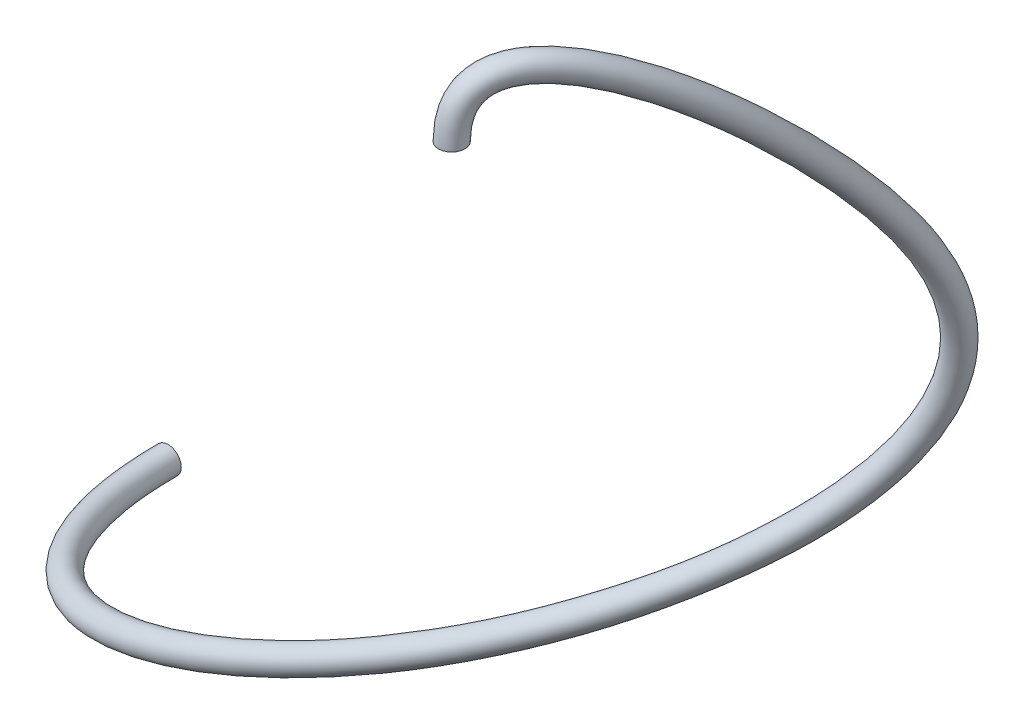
SolidWorks part; units mm, degrees
ref_plane "Płaszczyzna przednia" through (0, 0, 0) normal (0, 0, 1) x (1, 0, 0)
ref_plane "Płaszczyzna górna" through (0, 0, 0) normal (0, 1, 0) x (1, 0, 0)
ref_plane "Płaszczyzna prawa" through (0, 0, 0) normal (1, 0, 0) x (0, 0, -1)
sketch3d "Szkic 3D1"
  line L10 (0, 0, 0) -> (0, 0, 200) construction
  line L11 (0, 0, 200) -> (827.0105, -98.6349, -211.2897) construction
  line L16 (827.0105, -98.6349, -211.2897) -> (370, 772.9545, 209) construction
  line L21 (370, 772.9545, 209) -> (370, 446, 209) construction
  circle A8 centre (370, 446, 209) radius 5 construction
  spline_without_curve S0
  point P62 (370, 441, 209)
  dimension "D1" = 1000
  dimension "D2" = 200
sketch "Szkic2" plane through (0, 0, 0) normal (0, 0, 1) x (1, 0, 0)
  circle A0 centre (0, 0) radius 7.5
  dimension "D1" = 15
sweep "Wyciągnięcie po ścieżce1" add profiles "Szkic2" path "Szkic 3D1"
